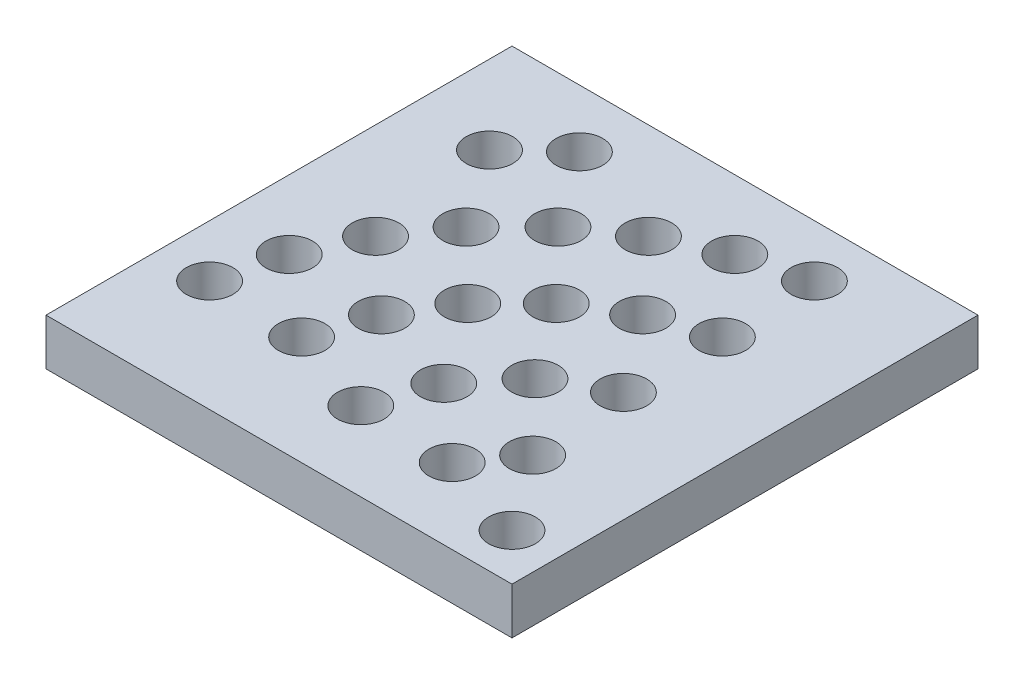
SolidWorks part; units mm, degrees
ref_plane "Front Plane" through (0, 0, 0) normal (0, 0, 1) x (1, 0, 0)
ref_plane "Top Plane" through (0, 0, 0) normal (0, 1, 0) x (1, 0, 0)
ref_plane "Right Plane" through (0, 0, 0) normal (1, 0, 0) x (0, 0, -1)
sketch "Sketch1" plane through (0, 0, 0) normal (0, 1, 0) x (1, 0, 0)
  line L1 (0, 0) -> (-50, 0)
  line L2 (0, 0) -> (0, 50)
  line L3 (0, 50) -> (-50, 50)
  line L4 (-50, 0) -> (-50, 50)
  dimension "D1" = 50
extrude "Extrude1" add sketch "Sketch1" along normal blind 5
sketch "Sketch4" plane through (0, 5, 0) normal (0, 1, 0) x (-1, 0, 0)
  line L2 (0, 0) -> (0, -50) construction
  line L3 (50, 0) -> (0, 0) construction
  circle A0 centre (5, -5) radius 2.5
  dimension "D1" = 5
  dimension "D2" = 5
  dimension "D3" = 5
extrude "Cut-Extrude2" cut sketch "Sketch4" against normal blind 10
other "Fill Pattern1" parameters "D4"=10, "D5"=7.0711, "D3"=3
